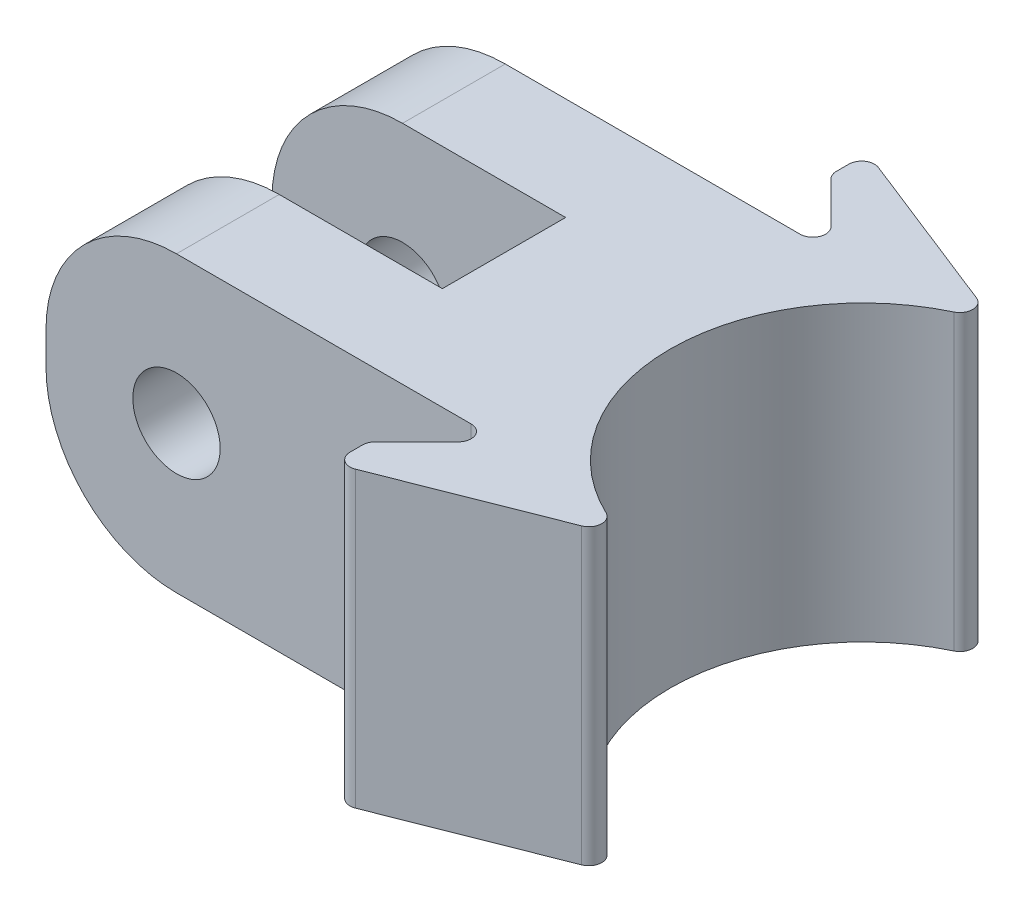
SolidWorks part; units mm, degrees
ref_plane "Front Plane" through (0, 0, 0) normal (0, 0, 1) x (1, 0, 0)
ref_plane "Top Plane" through (0, 0, 0) normal (0, 1, 0) x (1, 0, 0)
ref_plane "Right Plane" through (0, 0, 0) normal (1, 0, 0) x (0, 0, -1)
sketch "Sketch1" plane through (0, 0, 0) normal (0, 1, 0) x (1, 0, 0)
  line L0 (-158.9383, 0) -> (7787.9768, 0) construction
  line L1 (-11.43, 2.4) -> (0, 2.4)
  line L2 (0, 2.4) -> (0, -2.4)
  line L3 (0, -2.4) -> (-11.43, -2.4)
  line L4 (-11.43, 2.4) -> (-11.43, 6.4)
  line L5 (-11.43, 6.4) -> (6.3299, 6.4)
  line L6 (13.97, 6.4) -> (13.97, -6.4)
  line L7 (6.3299, -6.4) -> (-11.43, -6.4)
  line L8 (-11.43, -6.4) -> (-11.43, -2.4)
  line L9 (6.3299, 6.4) -> (3.7148, 9.0151)
  line L10 (3.7148, 9.0151) -> (3.7148, 10.444)
  line L11 (3.7148, 10.444) -> (13.97, 6.4)
  line L12 (3.7148, -10.444) -> (13.97, -6.4)
  line L13 (6.3299, -6.4) -> (3.7148, -9.0151)
  line L14 (3.7148, -9.0151) -> (3.7148, -10.444)
  point P5 (0, 0)
  dimension "D1" = 4.8
  dimension "D2" = 11.43
  dimension "D3" = 4
  dimension "D4" = 25.4
extrude "Boss-Extrude1" add sketch "Sketch1" along normal blind 11.43
fillet "Fillet1" radius 5.08 4 edges at (-11.43, 0, 4.4) (-11.43, 0, -4.4) (-11.43, 11.43, 4.4) (-11.43, 11.43, -4.4)
sketch "Sketch2" plane through (0, 0, 6.4) normal (0, 0, 1) x (1, 0, 0)
  line L0 (-6.35, 11.43) -> (-6.35, 0) construction
  point P6 (-6.35, 5.715)
hole_wizard "M3 Clearance Hole1" positions "Sketch3" profile "Sketch4" hole size "M3" standard "ANSI Metric"
sketch "Sketch3" plane through (0, 0, 6.4) normal (0, 0, 1) x (1, 0, 0)
  point P0 (-6.35, 5.715)
sketch "Sketch4" plane through (-6.35, 5.715, 6.4) normal (1, 0, 0) x (0, -1, 0)
  line L0 (0, 0) -> (0, 16.844)
  line L1 (0, 16.844) -> (1.7, 16.844)
  line L2 (1.7, 16.844) -> (1.7, 0)
  line L5 (1.7, 0) -> (0, 0)
  line L11 (0, -6.35) -> (0, 107.95) construction
  dimension "Thru Hole Dia." = 3.4
  dimension "Thru Hole Depth" = 16.844
sketch "Sketch5" plane through (0, 11.43, 0) normal (0, 1, 0) x (1, 0, 0)
  line L0 (13.97, -6.4) -> (13.97, 6.4) construction
  circle A0 centre (13.97, 0) radius 7.5
  dimension "D1" = 15
extrude "Cut-Extrude1" cut sketch "Sketch5" against normal through all both and the other way through all contours A0
fillet "Fillet2" radius 0.5 8 edges at (3.7148, 5.715, 10.444) (3.7148, 5.715, 9.0151) (6.3299, 5.715, 6.4) (6.3299, 5.715, -6.4) (3.7148, 5.715, -9.0151) (3.7148, 5.715, -10.444) (11.9112, 5.715, 7.2119) (11.9112, 5.715, -7.2119)
